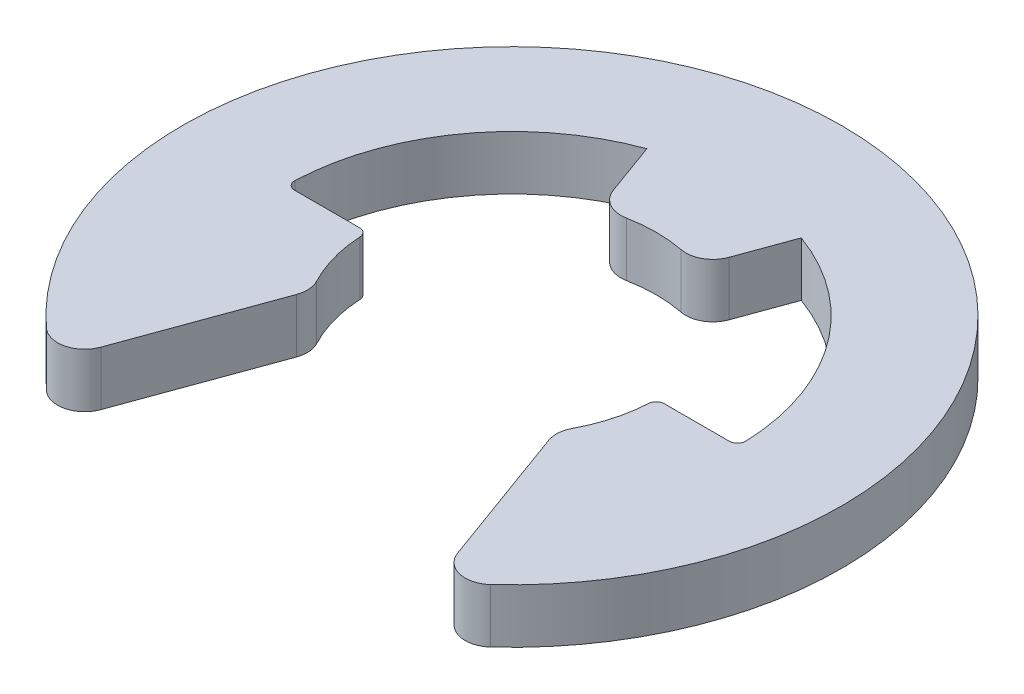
SolidWorks part; units mm, degrees
ref_plane "Front Plane" through (0, 0, 0) normal (0, 0, 1) x (1, 0, 0)
ref_plane "Top Plane" through (0, 0, 0) normal (0, 1, 0) x (1, 0, 0)
ref_plane "Right Plane" through (0, 0, 0) normal (1, 0, 0) x (0, 0, -1)
sketch "Sketch2" plane through (0, 0, 0) normal (0, 1, 0) x (1, 0, 0)
  line L0 (-2.1191, -2.9719) -> (-1.35, -0.8588)
  line L2 (1.35, -0.8588) -> (2.1191, -2.9719)
  line L4 (-1.6, 0) -> (-2.5, 0)
  line L5 (1.6, 0) -> (2.5, 0)
  line L6 (-0.8551, 2.3492) -> (-0.5472, 1.5035)
  line L8 (0.5472, 1.5035) -> (0.8551, 2.3492)
  arc A0 (2.1191, -2.9719) -> (-2.1191, -2.9719) centre (0, 0) ccw
  arc A1 (1.35, -0.8588) -> (1.6, 0) centre (0, 0) ccw
  arc A2 (2.5, 0) -> (0.8551, 2.3492) centre (0, 0) ccw
  arc A3 (-1.6, 0) -> (-1.35, -0.8588) centre (0, 0) ccw
  arc A4 (0.5472, 1.5035) -> (-0.5472, 1.5035) centre (0, 0) ccw
  arc A5 (-0.8551, 2.3492) -> (-2.5, 0) centre (0, 0) ccw
  point P15 (0, 0)
  point P16 (0, 1.6)
  dimension "D1" = 7.3
  dimension "D2" = 3.2
  dimension "D3" = 5
  dimension "D4" = 70
  dimension "D5" = 70
  dimension "D6" = 2.7
  dimension "D7" = 40
extrude "Boss-Extrude1" add sketch "Sketch2" along normal mid plane 0.6
fillet "Fillet1" radius 0.3 6 edges at (1.35, 0, 0.8588) (-1.35, 0, 0.8588) (0.5472, 0, -1.5035) (-0.5472, 0, -1.5035) (2.1191, 0, 2.9719) (-2.1191, 0, 2.9719)
fillet "Fillet2" radius 0.09 4 edges at (2.5, 0, 0) (1.6, 0, 0) (-2.5, 0, 0) (-1.6, 0, 0)
